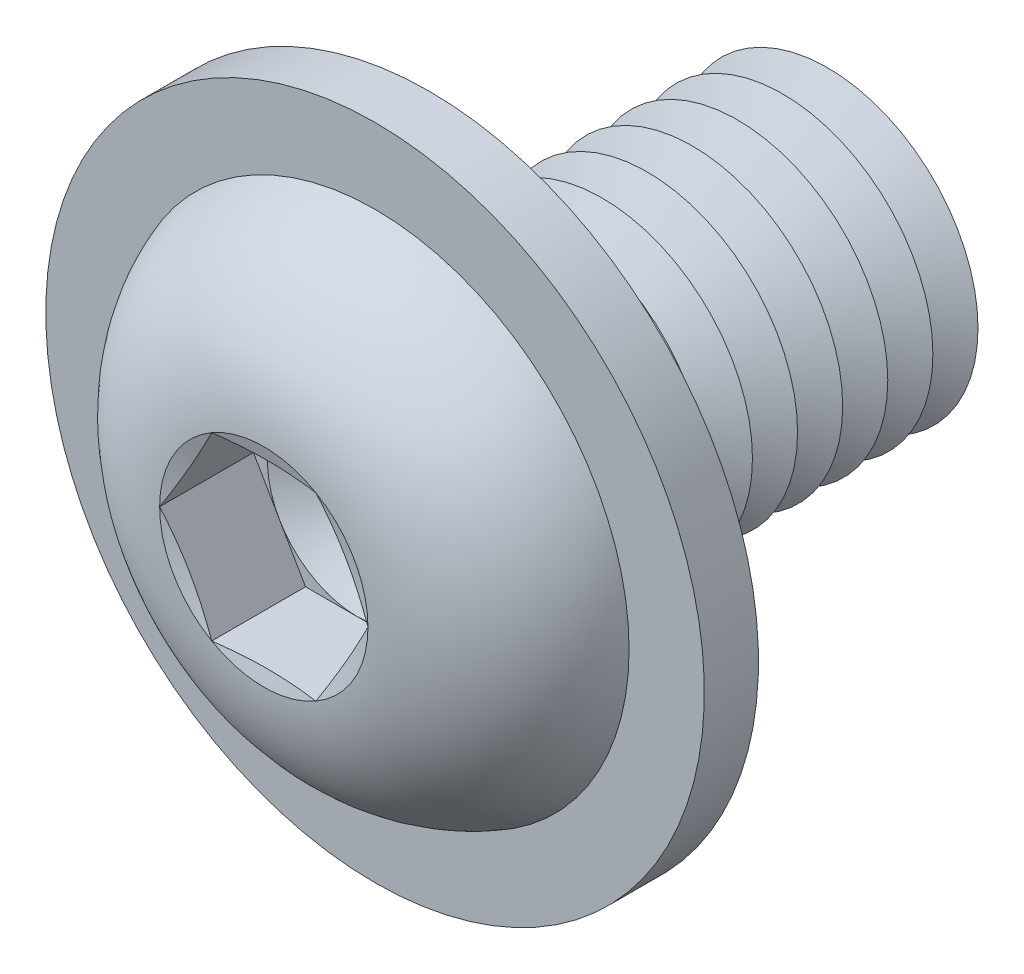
SolidWorks part; units mm, degrees
ref_plane "Front Plane" through (0, 0, 0) normal (0, 0, 1) x (1, 0, 0)
ref_plane "Top Plane" through (0, 0, 0) normal (0, 1, 0) x (1, 0, 0)
ref_plane "Right Plane" through (0, 0, 0) normal (1, 0, 0) x (0, 0, -1)
sketch "Sketch1" plane through (0, 0, 0) normal (1, 0, 0) x (0, 0, -1)
  line L0 (0, 5) -> (0, 8.75)
  line L3 (0, 5) -> (14, 5)
  line L4 (14, 5) -> (14, 0)
  line L5 (14, 0) -> (-5.5, 0) construction
  line L6 (-5.5, 0) -> (14, 0)
  line L7 (-5.5, 3.4641) -> (-5.5, 1.732) construction
  line L8 (-5.5, 1.732) -> (-5.5, 0)
  line L9 (-5.5, 3.4641) -> (-5.0359, 1.732)
  line L10 (-5.0359, 1.732) -> (-5.5, 1.732)
  line L11 (14, 0) -> (22.7481, 0) construction
  line L12 (0, 8.75) -> (-5.5, 8.75) construction
  arc A1 (0, 8.75) -> (-5.5, 3.4641) centre (0, 3.2457) ccw
  point P8 (14, 2.5)
  dimension "D1" = 17.5
  dimension "D2" = 10
  dimension "D3" = 5.5
  dimension "D4" = 6.9282
  dimension "D5" = 14
  dimension "D6" = 15
revolve "Revolve1" add sketch "Sketch1" angle 360 about L5
fillet "Fillet1" radius 0.75 1 edges at (-5, 0, 0)
sketch "Sketch2" plane through (0, 0, 0) normal (1, 0, 0) x (0, 0, -1)
  line L0 (13.25, 5) -> (14.75, 5)
  line L1 (14, 5) -> (0.75, 5) construction
  line L2 (14.75, 5) -> (14, 3.701)
  line L3 (14, -5) -> (14, 5) construction
  line L4 (14, 3.701) -> (13.25, 5)
  dimension "D1" = 1.5
revolve "Cut-Revolve1" cut sketch "Sketch2" angle 360 about axis through (0, 0, -14) along (0, 0, -1)
pattern_linear "LPattern1" count 9 spacing 1.5 along (0, 0, 1) of "Cut-Revolve1"
sketch "Sketch3" plane through (0, 0, 5.5) normal (0, 0, 1) x (1, 0, 0)
  line L7 (1.732, 3) -> (-1.7321, 3)
  line L8 (-1.7321, 3) -> (-3.4641, 0)
  line L9 (-3.4641, 0) -> (-1.732, -3)
  line L10 (-1.732, -3) -> (1.732, -3)
  line L11 (1.732, -3) -> (3.4641, 0)
  line L12 (3.4641, 0) -> (1.732, 3)
  circle A0 centre (0, 0) radius 3 construction
  circle A3 centre (0, 0) radius 3.4641 construction
extrude "Cut-Extrude1" cut sketch "Sketch3" against normal blind 3.12
sketch "Sketch4" plane through (0, 0, 2.38) normal (0, 0, 1) x (1, 0, 0)
  line L1 (1.732, 3) -> (-1.7321, 3) construction
  circle A0 centre (0, 0) radius 3
extrude "Cut-Extrude2" cut sketch "Sketch4" against normal through all draft 60
sketch "Sketch5" plane through (0, 0, 0) normal (0, 0, -1) x (-1, 0, 0)
  circle A0 centre (0, 0) radius 10.95
  circle A1 centre (0, 0) radius 5.75
  circle A2 centre (0, 0) radius 5.75 construction
  dimension "D1" = 21.9
extrude "Boss-Extrude1" add sketch "Sketch5" against normal blind 1.8
